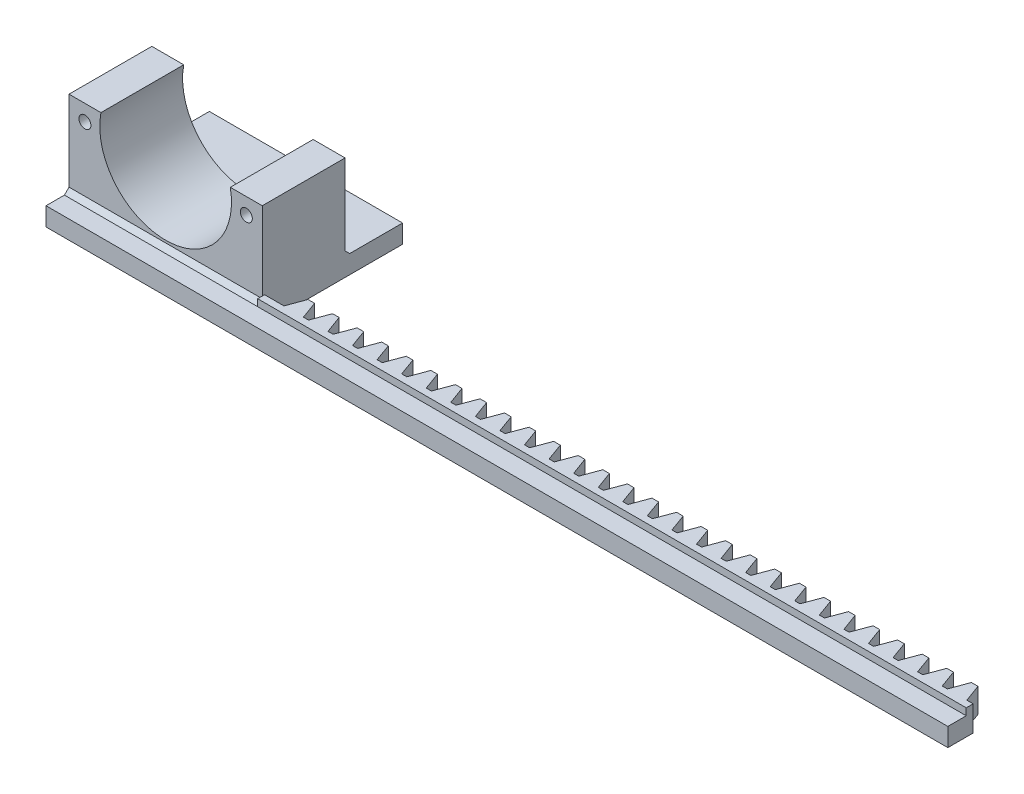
SolidWorks part; units mm, degrees
ref_plane "Front Plane" through (0, 0, 0) normal (0, 0, 1) x (1, 0, 0)
ref_plane "Top Plane" through (0, 0, 0) normal (0, 1, 0) x (1, 0, 0)
ref_plane "Right Plane" through (0, 0, 0) normal (1, 0, 0) x (0, 0, -1)
sketch "Sketch1" plane through (0, 0, 0) normal (0, 1, 0) x (1, 0, 0)
  line L0 (0, 0) -> (50, 0) construction
  line L1 (23.5675, 1.7) -> (25, 1.7)
  line L3 (25, 1.7) -> (26.3922, -2.125)
  line L4 (25, 1.7) -> (25, -12.1658) construction
  line L5 (25.6187, 0) -> (22.9487, 0) construction
  line L6 (24.2837, 0) -> (24.2837, 0.9173) construction
  line L7 (23.5675, 1.7) -> (22.1616, -2.125)
  line L8 (0, 1.7) -> (50, 1.7) construction
  line L9 (28.9075, 1.7) -> (30.34, 1.7)
  line L10 (28.9075, 1.7) -> (27.5016, -2.125)
  line L11 (30.34, 1.7) -> (31.7322, -2.125)
  line L12 (34.2475, 1.7) -> (35.68, 1.7)
  line L13 (34.2475, 1.7) -> (32.8416, -2.125)
  line L14 (35.68, 1.7) -> (37.0722, -2.125)
  line L15 (39.5875, 1.7) -> (41.02, 1.7)
  line L16 (39.5875, 1.7) -> (38.1816, -2.125)
  line L17 (41.02, 1.7) -> (42.4122, -2.125)
  line L18 (44.9275, 1.7) -> (46.36, 1.7)
  line L19 (44.9275, 1.7) -> (43.5216, -2.125)
  line L20 (46.36, 1.7) -> (47.7522, -2.125)
  line L21 (50.2675, 1.7) -> (51.7, 1.7)
  line L22 (50.2675, 1.7) -> (48.8616, -2.125)
  line L23 (51.7, 1.7) -> (53.0922, -2.125)
  line L24 (55.6075, 1.7) -> (57.04, 1.7)
  line L25 (55.6075, 1.7) -> (54.2016, -2.125)
  line L26 (57.04, 1.7) -> (58.4322, -2.125)
  line L27 (60.9475, 1.7) -> (62.38, 1.7)
  line L28 (60.9475, 1.7) -> (59.5416, -2.125)
  line L29 (62.38, 1.7) -> (63.7722, -2.125)
  line L30 (66.2875, 1.7) -> (67.72, 1.7)
  line L31 (66.2875, 1.7) -> (64.8816, -2.125)
  line L32 (67.72, 1.7) -> (69.1122, -2.125)
  line L33 (71.6275, 1.7) -> (73.06, 1.7)
  line L34 (71.6275, 1.7) -> (70.2216, -2.125)
  line L35 (73.06, 1.7) -> (74.4522, -2.125)
  line L36 (76.9675, 1.7) -> (78.4, 1.7)
  line L37 (76.9675, 1.7) -> (75.5616, -2.125)
  line L38 (78.4, 1.7) -> (79.7922, -2.125)
  line L39 (82.3075, 1.7) -> (83.74, 1.7)
  line L40 (82.3075, 1.7) -> (80.9016, -2.125)
  line L41 (83.74, 1.7) -> (85.1322, -2.125)
  line L42 (87.6475, 1.7) -> (89.08, 1.7)
  line L43 (87.6475, 1.7) -> (86.2416, -2.125)
  line L44 (89.08, 1.7) -> (90.4722, -2.125)
  line L45 (92.9875, 1.7) -> (94.42, 1.7)
  line L46 (92.9875, 1.7) -> (91.5816, -2.125)
  line L47 (94.42, 1.7) -> (95.8122, -2.125)
  line L48 (98.3275, 1.7) -> (99.76, 1.7)
  line L49 (98.3275, 1.7) -> (96.9216, -2.125)
  line L50 (99.76, 1.7) -> (101.1522, -2.125)
  line L51 (103.6675, 1.7) -> (105.1, 1.7)
  line L52 (103.6675, 1.7) -> (102.2616, -2.125)
  line L53 (105.1, 1.7) -> (106.4922, -2.125)
  line L54 (109.0075, 1.7) -> (110.44, 1.7)
  line L55 (109.0075, 1.7) -> (107.6016, -2.125)
  line L56 (110.44, 1.7) -> (111.8322, -2.125)
  line L57 (114.3475, 1.7) -> (115.78, 1.7)
  line L58 (114.3475, 1.7) -> (112.9416, -2.125)
  line L59 (115.78, 1.7) -> (117.1722, -2.125)
  line L60 (119.6875, 1.7) -> (121.12, 1.7)
  line L61 (119.6875, 1.7) -> (118.2816, -2.125)
  line L62 (121.12, 1.7) -> (122.5122, -2.125)
  line L63 (125.0275, 1.7) -> (126.46, 1.7)
  line L64 (125.0275, 1.7) -> (123.6216, -2.125)
  line L65 (126.46, 1.7) -> (127.8522, -2.125)
  line L66 (130.3675, 1.7) -> (131.8, 1.7)
  line L67 (130.3675, 1.7) -> (128.9616, -2.125)
  line L68 (131.8, 1.7) -> (133.1922, -2.125)
  line L69 (135.7075, 1.7) -> (137.14, 1.7)
  line L70 (135.7075, 1.7) -> (134.3016, -2.125)
  line L71 (137.14, 1.7) -> (138.5322, -2.125)
  line L72 (141.0475, 1.7) -> (142.48, 1.7)
  line L73 (141.0475, 1.7) -> (139.6416, -2.125)
  line L74 (142.48, 1.7) -> (143.8722, -2.125)
  line L75 (146.3875, 1.7) -> (147.82, 1.7)
  line L76 (146.3875, 1.7) -> (144.9816, -2.125)
  line L77 (147.82, 1.7) -> (149.2122, -2.125)
  line L78 (151.7275, 1.7) -> (153.16, 1.7)
  line L79 (151.7275, 1.7) -> (150.3216, -2.125)
  line L80 (153.16, 1.7) -> (154.5522, -2.125)
  line L81 (157.0675, 1.7) -> (158.5, 1.7)
  line L82 (157.0675, 1.7) -> (155.6616, -2.125)
  line L83 (158.5, 1.7) -> (159.8922, -2.125)
  line L84 (162.4075, 1.7) -> (163.84, 1.7)
  line L85 (162.4075, 1.7) -> (161.0016, -2.125)
  line L86 (163.84, 1.7) -> (165.2322, -2.125)
  line L87 (167.7475, 1.7) -> (169.18, 1.7)
  line L88 (167.7475, 1.7) -> (166.3416, -2.125)
  line L89 (169.18, 1.7) -> (170.5722, -2.125)
  line L91 (17.9487, -2.125) -> (171.9487, -2.125)
  line L92 (17.9487, -2.125) -> (17.9487, -3.625)
  line L93 (17.9487, -3.625) -> (171.9487, -3.625)
  line L94 (171.9487, -2.125) -> (171.9487, -3.625)
  dimension "D1" = 50
  dimension "D4" = 20
  dimension "D5" = 2.67
  dimension "D6" = 28
  dimension "D3" = 2.125
  dimension "D7" = 1.5
  dimension "D8" = 154
  dimension "D9" = 5
  dimension "D2" = 1.7
extrude "Boss-Extrude1" add sketch "Sketch1" along normal mid plane 5.28 contours L94 L91 | L88 L91 L89 L87 | L85 L91 L86 L84 | L82 L91 L83 L81 | L79 L91 L80 L78 | L76 L91 L77 L75 | L73 L91 L74 L72 | L70 L91 L71 L69 | L67 L91 L68 L66 | L64 L91 L65 L63 | L61 L91 L62 L60 | L58 L91 L59 L57 | L55 L91 L56 L54 | L52 L91 L53 L51 | L49 L91 L50 L48 | L46 L91 L47 L45 | L43 L91 L44 L42 | L40 L91 L41 L39 | L37 L91 L38 L36 | L34 L91 L35 L33 | L31 L91 L32 L30 | L28 L91 L29 L27 | L25 L91 L26 L24 | L22 L91 L23 L21 | L19 L91 L20 L18 | L16 L91 L17 L15 | L13 L91 L14 L12 | L10 L91 L11 L9 | L7 L91 L3 L1
sketch "Sketch2" plane through (0, -2.64, 0) normal (0, -1, 0) x (1, 0, 0)
  line L1 (17.9487, 3.625) -> (171.9487, 3.625)
  line L2 (17.9487, 3.625) -> (17.9487, 2.125)
  line L3 (17.9487, 2.125) -> (171.9487, 2.125)
  line L4 (171.9487, 3.625) -> (171.9487, 2.125)
extrude "Boss-Extrude2" add sketch "Sketch2" along normal blind 0.22
sketch "Sketch3" plane through (171.9487, 0, 0) normal (1, 0, 0) x (0, 0, -1)
  line L1 (-3.625, -2.86) -> (-7.625, -2.86)
  line L2 (-3.625, -2.86) -> (-3.625, 1.14)
  line L3 (-3.625, 1.14) -> (-7.625, 1.14)
  line L4 (-7.625, -2.86) -> (-7.625, 1.14)
  dimension "D1" = 4
  dimension "D2" = 4
extrude "Boss-Extrude3" add sketch "Sketch3" against normal blind 154 contours L2 L1 L4 L3
sketch "Sketch4" plane through (0, -2.86, 0) normal (0, -1, 0) x (1, 0, 0)
  line L1 (17.9487, 7.625) -> (-24.0513, 7.625)
  line L2 (17.9487, 7.625) -> (17.9487, -27.875)
  line L3 (17.9487, -27.875) -> (-24.0513, -27.875)
  line L4 (-24.0513, 7.625) -> (-24.0513, -27.875)
  dimension "D1" = 42
  dimension "D2" = 35.5
extrude "Boss-Extrude4" add sketch "Sketch4" against normal blind 4
sketch "Sketch6" plane through (0, 1.14, 0) normal (0, 1, 0) x (1, 0, 0)
  line L0 (-24.0513, -7.625) -> (-24.0513, 27.875) construction
  line L1 (-24.0513, 15.375) -> (17.9487, 15.375)
  line L2 (-24.0513, 15.375) -> (-24.0513, -2.625)
  line L3 (-24.0513, -2.625) -> (17.9487, -2.625)
  line L4 (17.9487, 15.375) -> (17.9487, -2.625)
  line L5 (17.9487, 27.875) -> (17.9487, -2.125) construction
  line L6 (-24.0513, -7.625) -> (171.9487, -7.625) construction
  dimension "D1" = 18
  dimension "D2" = 5
extrude "Boss-Extrude5" add sketch "Sketch6" along normal blind 18.5
sketch "Sketch7" plane through (0, 0, 2.625) normal (0, 0, 1) x (1, 0, 0)
  line L0 (-24.0513, 19.64) -> (17.9487, 19.64) construction
  line L1 (-24.0513, 1.14) -> (17.9487, 1.14) construction
  line L2 (-24.0513, 19.64) -> (-24.0513, 1.14) construction
  circle A0 centre (-3.0513, 16.9542) radius 14.3142
  point P0 (-17.1113, 19.64)
  point P1 (11.0087, 19.64)
  point P4 (-3.0513, 2.64)
  dimension "D1" = 6.94
  dimension "D2" = 6.94
  dimension "D3" = 1.5
  dimension "D4" = 21
extrude "Cut-Extrude1" cut sketch "Sketch7" against normal blind 18.5
sketch "Sketch8" plane through (-24.0513, 0, 0) normal (-1, 0, 0) x (0, 0, 1)
  line L0 (-16.375, 1.14) -> (-15.375, 2.14)
  line L1 (-15.375, 1.14) -> (-27.875, 1.14) construction
  line L2 (-15.375, 19.64) -> (-15.375, 1.14) construction
  line L3 (-15.375, 2.14) -> (-15.375, 1.14)
  line L4 (-15.375, 1.14) -> (-16.375, 1.14)
  line L5 (2.625, 2.14) -> (3.625, 1.14)
  line L6 (2.625, 19.64) -> (2.625, 1.14) construction
  line L7 (7.625, 1.14) -> (2.625, 1.14) construction
  line L8 (3.625, 1.14) -> (2.625, 1.14)
  line L9 (2.625, 1.14) -> (2.625, 2.14)
  dimension "D1" = 1
  dimension "D2" = 1
  dimension "D3" = 1
  dimension "D4" = 1
extrude "Boss-Extrude6" add sketch "Sketch8" against normal up to vertex
sketch "Sketch9" plane through (0, 0, 2.625) normal (0, 0, 1) x (1, 0, 0)
  line L0 (-24.0513, 19.64) -> (-24.0513, 2.14) construction
  line L1 (-24.0513, 19.64) -> (-17.1113, 19.64) construction
  line L2 (17.9487, 19.64) -> (17.9487, 2.64) construction
  line L4 (11.0087, 19.64) -> (17.9487, 19.64) construction
  circle A0 centre (-20.5913, 16.14) radius 1.3
  circle A1 centre (14.4887, 16.14) radius 1.3
  dimension "D1" = 2.6
  dimension "D2" = 2.6
  dimension "D6" = 2.2
  dimension "D3" = 2.16
  dimension "D4" = 2.2
  dimension "D5" = 2.16
extrude "Cut-Extrude2" cut sketch "Sketch9" against normal blind 18.5
